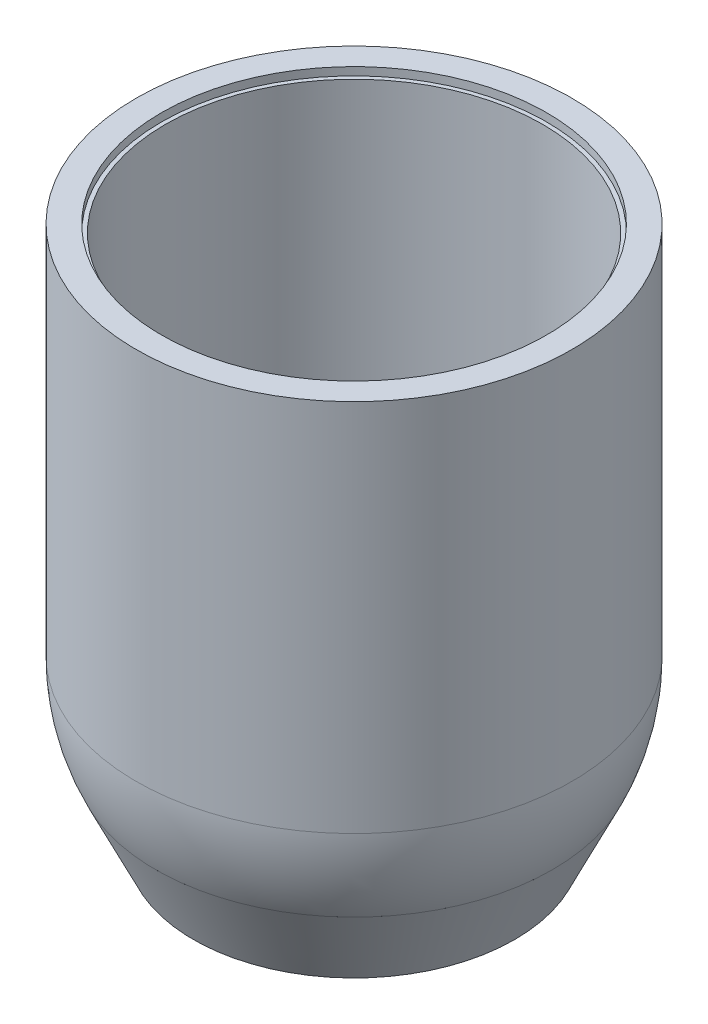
SolidWorks part; units mm, degrees
ref_plane "Face" through (0, 0, 0) normal (0, 0, 1) x (1, 0, 0)
ref_plane "Dessus" through (0, 0, 0) normal (0, 1, 0) x (1, 0, 0)
ref_plane "Droite" through (0, 0, 0) normal (1, 0, 0) x (0, 0, -1)
sketch "Esquisse1" plane through (0, 0, 0) normal (0, 0, 1) x (1, 0, 0)
  line L0 (0, 0) -> (0, -185.45)
  line L1 (0, 0) -> (12.5, 0)
  line L2 (12.5, 0) -> (12.5, -4)
  line L3 (12.5, -4) -> (14.5, -4)
  line L4 (14.5, -4) -> (14.5, -163.5)
  line L5 (14.5, -163.5) -> (12.5, -163.5)
  line L6 (12.5, -163.5) -> (12.5, -208.5)
  line L7 (108, 121.9333) -> (108, -416.236) construction
  line L8 (28.32, -267.5) -> (33.2878, -267.5)
  line L9 (28.32, -267.5) -> (9.6268, -228.15)
  line L10 (31.5563, -265.1163) -> (12.7684, -210.1163)
  line L11 (99.5123, -185.45) -> (-37.9762, -185.45) construction
  line L12 (99.5123, -185.45) -> (-38.7151, -251.1148) construction
  line L13 (9.6268, -228.15) -> (9.6279, -228.1495)
  arc A0 (0, -185.45) -> (9.6279, -228.1495) centre (99.5, -185.45) ccw
  arc A1 (31.5563, -265.1163) -> (33.2878, -267.5) centre (36.2878, -263.5) ccw
  arc A2 (12.5, -208.5) -> (12.7684, -210.1163) centre (17.5, -208.5) ccw
  arc A3 (31.5563, -265.1163) -> (36.2878, -268.5) centre (36.2878, -263.5) ccw construction
  dimension "D9" = 8.5
  dimension "D14" = 10
  dimension "D17" = 10
  dimension "D11" = 199
  dimension "D2" = 12.5
  dimension "D3" = 4
  dimension "D4" = 2
  dimension "D5" = 163.5
  dimension "D6" = 2
  dimension "D7" = 45
  dimension "D8" = 108
  dimension "D10" = 185.45
  dimension "D12" = 267.5
  dimension "D13" = 79.68
  dimension "D15" = 25.41
  dimension "D16" = 18.86
  dimension "D21" = 25.41
  dimension "D22" = 39.35
revolve "Révolution1" add sketch "Esquisse1" angle 360 about L7
